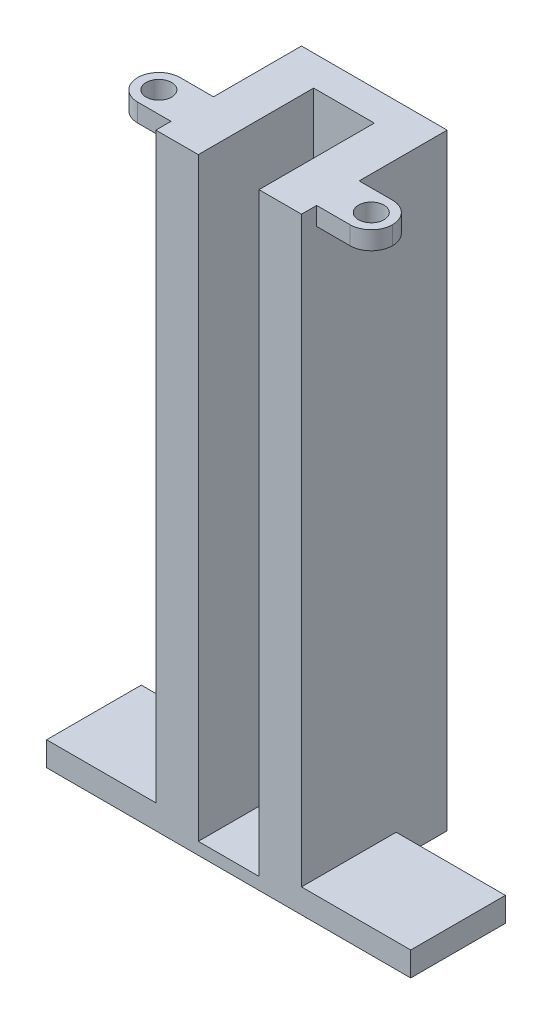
SolidWorks part; units mm, degrees
ref_plane "Front Plane" through (0, 0, 0) normal (0, 0, 1) x (1, 0, 0)
ref_plane "Top Plane" through (0, 0, 0) normal (0, 1, 0) x (1, 0, 0)
ref_plane "Right Plane" through (0, 0, 0) normal (1, 0, 0) x (0, 0, -1)
sketch "Sketch1" plane through (0, 0, 0) normal (0, 1, 0) x (1, 0, 0)
  line L1 (-12, 12) -> (12, 12)
  line L2 (-12, 12) -> (-12, -12)
  line L3 (-12, -12) -> (12, -12)
  line L4 (12, 12) -> (12, -12)
  line L5 (-12, 12) -> (12, -12) construction
  line L6 (-12, -12) -> (12, 12) construction
  point P0 (0, 0)
extrude "Boss-Extrude1" add sketch "Sketch1" along normal blind 100
sketch "Sketch3" plane through (0, 100, 0) normal (0, 1, 0) x (1, 0, 0)
  line L0 (-12, -12) -> (12, -12) construction
  line L1 (-5, -12) -> (5, -12)
  line L2 (-5, -12) -> (-5, 7)
  line L3 (-5, 7) -> (5, 7)
  line L4 (5, -12) -> (5, 7)
extrude "Cut-Extrude1" cut sketch "Sketch3" against normal offset from surface (98 mm away) 2
sketch "Sketch6" plane through (-12, 0, 0) normal (-1, 0, 0) x (0, 0, 1)
  line L0 (-12, 100) -> (-12, 0) construction
  line L1 (12, 0) -> (-12, 0)
  line L2 (12, 0) -> (12, 4)
  line L3 (12, 4) -> (-12, 4)
  line L4 (-12, 0) -> (-12, 4)
  dimension "D1" = 4
extrude "Boss-Extrude3" add sketch "Sketch6" along normal blind 18
sketch "Sketch7" plane through (0, 4, 0) normal (0, 1, 0) x (1, 0, 0)
  line L0 (-12, -12) -> (-12, 12) construction
  line L1 (-30, 12) -> (-12, 12)
  line L2 (-30, 12) -> (-30, 3.6)
  line L3 (-30, 3.6) -> (-12, 3.6)
  line L4 (-12, 12) -> (-12, 3.6)
extrude "Cut-Extrude3" cut sketch "Sketch7" against normal up to surface (4 mm away)
mirror "Mirror2" about plane through (0, 0, 0) normal (1, 0, 0) of "Cut-Extrude3", "Boss-Extrude3"
sketch "Sketch8" plane through (0, 2, 0) normal (0, 1, 0) x (1, 0, 0)
  line L0 (-5, 7) -> (5, 7) construction
  circle A0 centre (0, 2) radius 4
extrude "Cut-Extrude4" cut sketch "Sketch8" against normal blind 1
sketch "Sketch9" plane through (0, 100, 0) normal (0, 1, 0) x (1, 0, 0)
  line L0 (-12, -12) -> (-12, 3.6) construction
  line L1 (-21, -2.5) -> (-12, -2.5)
  line L2 (-21, -2.5) -> (-21, -9.5)
  line L3 (-21, -9.5) -> (-12, -9.5)
  line L4 (-12, -2.5) -> (-12, -9.5)
  line L5 (-21, -2.5) -> (-12, -9.5) construction
  line L6 (-21, -9.5) -> (-12, -2.5) construction
  circle A0 centre (0, 2) radius 4 construction
  circle A1 centre (0, 2) radius 4 construction
  point P0 (-16.5, -6)
extrude "Boss-Extrude4" add sketch "Sketch9" against normal blind 3
fillet "Fillet1" radius 3.5 2 edges at (-21, 98.5, 2.5) (-21, 98.5, 9.5)
sketch "Sketch10" plane through (0, 100, 0) normal (0, 1, 0) x (1, 0, 0)
  circle A0 centre (-17.5, -6) radius 2.1
extrude "Cut-Extrude5" cut sketch "Sketch10" against normal up to surface (3 mm away)
mirror "Mirror3" about plane through (0, 0, 0) normal (1, 0, 0) of "Boss-Extrude4", "Fillet1", "Cut-Extrude5"
equation "\"rail width\"= 24"
equation "\"system width\"= 125"
equation "\"system depth\"= 250"
equation "\"internal height\"= 100"
equation "\"carriage height\"= 24"
equation "\"belt width\"= 6"
equation "\"worm gear diameter\"= 8"
equation "\"D1@Sketch1\"=\"rail width\""
equation "\"D2@Sketch1\"=\"rail width\""
equation "\"D1@Boss-Extrude1\"=\"internal height\""
equation "\"D1@Sketch3\"=\"worm gear diameter\"+2"
equation "\"D2@Sketch3\"=(\"rail width\"+\"worm gear diameter\")/2+3"
equation "\"D3@Sketch3\"=(\"worm gear diameter\"+2)/2"
equation "\"motor mounting hole spacing\" = 35"
equation "\"motor hole radius\"= 4.2"
equation "\"motor diameter\"= 28"
equation "\"rotor shelf diameter\"= 9"
equation "\"rotor centre from motor centre\"= 8"
equation "\"pin radius\"= 2.7"
equation "\"pin spacing\"= 9"
equation "\"D1@Sketch7\"=\"rail width\"/2-3.6"
equation "\"D1@Sketch8\"=\"worm gear diameter\""
equation "\"D2@Sketch8\"=\"worm gear diameter\"/2+1"
equation "\"D1@Sketch9\"=7"
equation "\"D2@Sketch9\"=\"rotor centre from motor centre\""
equation "\"D3@Sketch9\"=\"motor mounting hole spacing\"/2+3.5"
equation "\"D1@Sketch10\"=\"motor hole radius\""
